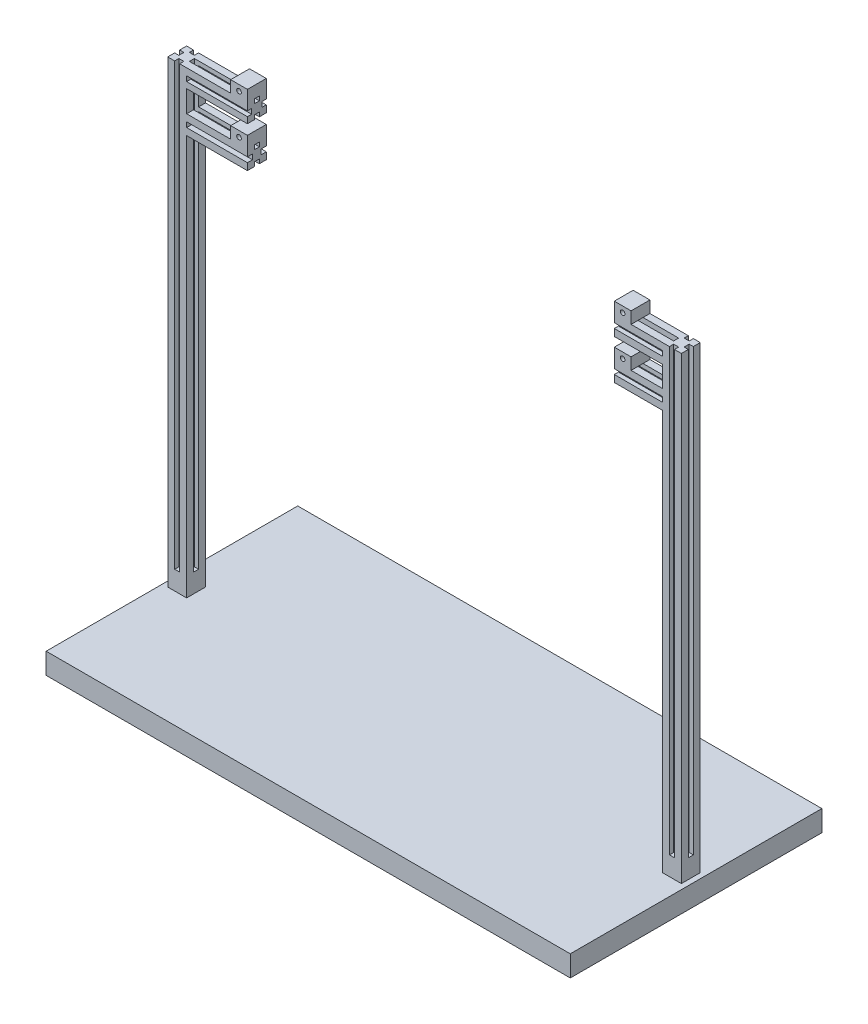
SolidWorks part; units mm, degrees
ref_plane "Front Plane" through (0, 0, 0) normal (0, 0, 1) x (1, 0, 0)
ref_plane "Top Plane" through (0, 0, 0) normal (0, 1, 0) x (1, 0, 0)
ref_plane "Right Plane" through (0, 0, 0) normal (1, 0, 0) x (0, 0, -1)
sketch "Schizzo1" plane through (0, 0, 0) normal (0, 1, 0) x (1, 0, 0)
  line L1 (-625, 300) -> (625, 300)
  line L2 (-625, 300) -> (-625, -300)
  line L3 (-625, -300) -> (625, -300)
  line L4 (625, 300) -> (625, -300)
  dimension "D1" = 1250
  dimension "D2" = 625
  dimension "D3" = 600
  dimension "D4" = 300
extrude "Estrusione-Estrusione1" add sketch "Schizzo1" along normal blind 50
sketch "Schizzo2" plane through (0, 50, 0) normal (0, 1, 0) x (1, 0, 0)
  line L0 (-625, -300) -> (625, -300) construction
  line L1 (-612.5, 22.5) -> (-567.5, 22.5)
  line L2 (-612.5, 22.5) -> (-612.5, -22.5)
  line L3 (-612.5, -22.5) -> (-567.5, -22.5)
  line L4 (-567.5, 22.5) -> (-567.5, -22.5)
  dimension "D1" = 45
  dimension "D2" = 45
  dimension "D3" = 277.5
  dimension "D4" = 612.5
extrude "Estrusione-Estrusione2" add sketch "Schizzo2" along normal blind 1095
sketch "Schizzo3" plane through (0, 50, 0) normal (0, 1, 0) x (1, 0, 0)
  line L0 (625, 300) -> (-625, 300) construction
  line L1 (567.5, 22.5) -> (612.5, 22.5)
  line L2 (567.5, 22.5) -> (567.5, -22.5)
  line L3 (567.5, -22.5) -> (612.5, -22.5)
  line L4 (612.5, 22.5) -> (612.5, -22.5)
  dimension "D1" = 45
  dimension "D2" = 45
  dimension "D3" = 277.5
  dimension "D4" = 612.5
extrude "Estrusione-Estrusione3" add sketch "Schizzo3" along normal blind 1095
sketch "Schizzo4" plane through (0, 1145, 0) normal (0, 1, 0) x (1, 0, 0)
  line L0 (-612.5, 22.5) -> (-612.5, -22.5) construction
  line L1 (-612.5, -22.5) -> (-567.5, -22.5)
  line L2 (-612.5, -22.5) -> (-612.5, 22.5)
  line L3 (-612.5, 22.5) -> (-567.5, 22.5)
  line L4 (-567.5, -22.5) -> (-567.5, 22.5)
  line L5 (-612.5, 22.5) -> (-612.5, -22.5) construction
  line L6 (-497.3635, 0) -> (-565.7304, 0) construction
  line L7 (-596, -22.5) -> (-584, -22.5)
  line L8 (-596, -22.5) -> (-596, -12.5)
  line L9 (-596, -12.5) -> (-584, -12.5)
  line L10 (-584, -22.5) -> (-584, -12.5)
  line L12 (-612.5, 6) -> (-602.5, 6)
  line L13 (-612.5, 6) -> (-612.5, -6)
  line L14 (-612.5, -6) -> (-602.5, -6)
  line L15 (-567.5, 6) -> (-577.5, 6)
  line L16 (-567.5, 6) -> (-567.5, -6)
  line L17 (-567.5, -6) -> (-577.5, -6)
  line L18 (-577.5, 6) -> (-577.5, -6)
  line L19 (-584, 22.5) -> (-584, 12.5)
  line L20 (-612.5, 6) -> (-612.5, -6)
  line L21 (-596, 12.5) -> (-584, 12.5)
  line L22 (-596, 22.5) -> (-596, 12.5)
  line L23 (-531.5443, -29.149) -> (-559.7543, -9.972) construction
  line L24 (0, 215.9687) -> (0, -207.4603) construction
  line L30 (-602.5, 6) -> (-602.5, -6)
  dimension "D1" = 12
  dimension "D2" = 16.5
  dimension "D3" = 12
  dimension "D4" = 10
  dimension "D5" = 10
  dimension "D6" = 16.5
  dimension "D7" = 22.5
  dimension "D8" = 10
  dimension "D9" = 12
  dimension "D10" = 16.5
extrude "Taglio-Estrusione1" cut sketch "Schizzo4" against normal blind 1050 contours L3 L22 L21 L19 | L30 L12 L2 L14 | L1 L10 L9 L8 | L15 L18 L17 L4
sketch "Schizzo5" plane through (0, 1145, 0) normal (0, 1, 0) x (1, 0, 0)
  line L0 (590, 25.1741) -> (590, -27.4304) construction
  line L1 (567.5, 22.5) -> (612.5, 22.5)
  line L2 (567.5, 22.5) -> (567.5, -22.5)
  line L3 (567.5, -22.5) -> (612.5, -22.5)
  line L4 (612.5, 22.5) -> (612.5, -22.5)
  line L5 (512.2544, 0) -> (588.0969, 0) construction
  line L6 (612.5, -6) -> (602.5, -6)
  line L7 (584, -22.5) -> (596, -22.5)
  line L8 (584, -22.5) -> (584, -12.5)
  line L9 (584, -12.5) -> (596, -12.5)
  line L10 (596, -22.5) -> (596, -12.5)
  line L11 (567.5, 6) -> (577.5, 6)
  line L12 (567.5, 6) -> (567.5, -6)
  line L13 (567.5, -6) -> (577.5, -6)
  line L14 (577.5, 6) -> (577.5, -6)
  line L15 (602.5, 6) -> (602.5, -6)
  line L16 (612.5, 6) -> (602.5, 6)
  line L17 (596, 22.5) -> (596, 12.5)
  line L18 (584, 22.5) -> (584, 12.5)
  line L19 (584, 12.5) -> (596, 12.5)
  dimension "D1" = 22.5
  dimension "D2" = 22.5
  dimension "D3" = 12
  dimension "D4" = 6
  dimension "D5" = 10
  dimension "D6" = 10
  dimension "D7" = 12
  dimension "D8" = 6
extrude "Taglio-Estrusione2" cut sketch "Schizzo5" against normal blind 1050 contours L18 L19 L17 L1 | L14 L11 L2 L13 | L3 L10 L9 L8 | L4 L16 L15 L6
sketch "Schizzo6" plane through (-567.5, 0, 0) normal (1, 0, 0) x (0, 0, -1)
  line L0 (-22.5, 1145) -> (-22.5, 50) construction
  line L1 (-22.5, 1050) -> (22.5, 1050)
  line L2 (-22.5, 754.8611) -> (-22.5, 1005)
  line L3 (-22.5, 1005) -> (22.5, 1005)
  line L4 (22.5, 754.8611) -> (22.5, 1005)
  line L5 (22.5, 1145) -> (22.5, 50) construction
  line L6 (6, 95) -> (6, 1145) construction
  line L7 (-6, 1005) -> (6, 1005)
  line L8 (-6, 1005) -> (-6, 1015)
  line L9 (-6, 1015) -> (6, 1015)
  line L10 (6, 1005) -> (6, 1015)
  line L12 (-22.5, 1145) -> (-22.5, 50) construction
  line L13 (22.5, 1145) -> (22.5, 50) construction
  line L14 (-6, 95) -> (-6, 1145) construction
  line L15 (-6, 1050) -> (6, 1050)
  line L16 (-6, 1050) -> (-6, 1040)
  line L17 (-6, 1040) -> (6, 1040)
  line L18 (6, 1050) -> (6, 1040)
  line L19 (6, 95) -> (6, 1145) construction
  line L20 (-31.6355, 1027.5) -> (43.3872, 1027.5) construction
  line L21 (22.5, 1033.5) -> (9.7907, 1033.5)
  line L22 (22.5, 1033.5) -> (22.5, 1021.5)
  line L23 (22.5, 1021.5) -> (9.7907, 1021.5)
  line L24 (9.7907, 1033.5) -> (9.7907, 1021.5)
  line L25 (-22.5, 1033.5) -> (-10.5, 1033.5)
  line L26 (-22.5, 50) -> (22.5, 50) construction
  line L27 (-22.5, 1033.5) -> (-22.5, 1021.5)
  line L28 (-22.5, 1021.5) -> (-10.5, 1021.5)
  line L29 (-10.5, 1033.5) -> (-10.5, 1021.5)
  dimension "D2" = 45
  dimension "D3" = 10
  dimension "D4" = 12
  dimension "D5" = 12
  dimension "D6" = 12
  dimension "D7" = 6
  dimension "D8" = 22.5
  dimension "D9" = 6
  dimension "D10" = 955
  dimension "D11" = 10
  dimension "D12" = 12
extrude "Estrusione-Estrusione4" add sketch "Schizzo6" along normal blind 145 contours L20 L29 L28 L3 M6 M4 | L20 L9 M4 M2 | L20 L3 L23 L24 M2 M8 | L20 L17 M4 M2 | L29 L20 L1 L25 M4 M6 | L20 L24 L21 L1 M2 M8
sketch "Schizzo9" plane through (567.5, 0, 0) normal (-1, 0, 0) x (0, 0, 1)
  line L0 (-22.5, 1145) -> (-22.5, 50) construction
  line L1 (-22.5, 1005) -> (22.5, 1005)
  line L2 (-22.5, 1005) -> (-22.5, 1050)
  line L3 (-22.5, 1050) -> (22.5, 1050)
  line L4 (22.5, 1005) -> (22.5, 1050)
  line L5 (22.5, 1145) -> (22.5, 50) construction
  line L7 (6, 95) -> (6, 1145) construction
  line L8 (-6, 1005) -> (6, 1005)
  line L9 (-6, 1005) -> (-6, 1015)
  line L10 (-6, 1015) -> (6, 1015)
  line L11 (6, 1005) -> (6, 1015)
  line L12 (-6, 95) -> (-6, 1145) construction
  line L13 (-6, 1050) -> (6, 1050)
  line L14 (-6, 1050) -> (-6, 1040)
  line L15 (-6, 1040) -> (6, 1040)
  line L16 (6, 1050) -> (6, 1040)
  line L17 (6, 95) -> (6, 1145) construction
  line L18 (-28.8999, 1027.5) -> (28.9688, 1027.5) construction
  line L19 (-22.5, 1033.5) -> (-12.5, 1033.5)
  line L20 (-22.5, 1033.5) -> (-22.5, 1021.5)
  line L21 (-22.5, 1021.5) -> (-12.5, 1021.5)
  line L22 (-12.5, 1033.5) -> (-12.5, 1021.5)
  line L23 (22.5, 1033.5) -> (12.5, 1033.5)
  line L24 (22.5, 1033.5) -> (22.5, 1021.5)
  line L25 (22.5, 1021.5) -> (12.5, 1021.5)
  line L26 (12.5, 1033.5) -> (12.5, 1021.5)
  line L28 (-300, 50) -> (300, 50) construction
  dimension "D1" = 955
  dimension "D2" = 45
  dimension "D3" = 10
  dimension "D4" = 10
  dimension "D5" = 12
  dimension "D6" = 10
  dimension "D7" = 10
  dimension "D8" = 12
  dimension "D9" = 6
extrude "Estrusione-Estrusione6" add sketch "Schizzo9" along normal blind 115 contours L18 L15 M4 M2 | L18 L10 M4 M2 | L18 L1 L25 L26 M2 M8 | L18 L22 L21 L1 M6 M4 | L22 L18 L3 L19 M4 M6 | L18 L26 L23 L4 L3 M2
sketch "Schizzo10" plane through (0, 1050, 0) normal (0, 1, 0) x (1, 0, 0)
  line L0 (-422.5, -22.5) -> (-567.5, -22.5) construction
  line L1 (-422.5, 22.5) -> (-462.5, 22.5)
  line L2 (-422.5, 22.5) -> (-422.5, -22.5)
  line L3 (-422.5, -22.5) -> (-462.5, -22.5)
  line L4 (-462.5, 22.5) -> (-462.5, -22.5)
  dimension "D1" = 40
extrude "Estrusione-Estrusione7" add sketch "Schizzo10" along normal blind 28
sketch "Schizzo11" plane through (0, 0, 22.5) normal (0, 0, 1) x (1, 0, 0)
  line L0 (-462.5, 1078) -> (-462.5, 1050) construction
  line L1 (-462.5, 1078) -> (-422.5, 1078) construction
  circle A0 centre (-442.5, 1064) radius 5.5
  dimension "D1" = 11
  dimension "D2" = 20
  dimension "D3" = 14
extrude "Taglio-Estrusione3" cut sketch "Schizzo11" against normal blind 45
sketch "Schizzo12" plane through (0, 1050, 0) normal (0, 1, 0) x (1, 0, 0)
  line L0 (452.5, -22.5) -> (567.5, -22.5) construction
  line L1 (452.5, 22.5) -> (492.5, 22.5)
  line L2 (452.5, 22.5) -> (452.5, -22.5)
  line L3 (452.5, -22.5) -> (492.5, -22.5)
  line L4 (492.5, 22.5) -> (492.5, -22.5)
  dimension "D1" = 40
extrude "Estrusione-Estrusione8" add sketch "Schizzo12" along normal blind 28
sketch "Schizzo13" plane through (0, 0, 22.5) normal (0, 0, 1) x (1, 0, 0)
  line L0 (452.5, 1033.5) -> (452.5, 1078) construction
  line L1 (452.5, 1078) -> (492.5, 1078) construction
  circle A0 centre (472.5, 1064) radius 5.5
  dimension "D1" = 11
  dimension "D2" = 20
  dimension "D3" = 14
extrude "Taglio-Estrusione4" cut sketch "Schizzo13" against normal blind 45
sketch "Schizzo14" plane through (-567.5, 0, 0) normal (1, 0, 0) x (0, 0, -1)
  line L0 (22.5, 1145) -> (22.5, 1050) construction
  line L1 (-22.5, 1145) -> (22.5, 1145)
  line L2 (-22.5, 1145) -> (-22.5, 1101.9247)
  line L3 (-22.5, 1101.9247) -> (22.5, 1101.9247)
  line L4 (22.5, 1145) -> (22.5, 1101.9247)
  line L5 (-6, 1050) -> (-6, 1145) construction
  line L6 (-22.5, 1128.5) -> (-12.5, 1128.5)
  line L7 (-22.5, 1128.5) -> (-22.5, 1116.5)
  line L8 (-22.5, 1116.5) -> (-12.5, 1116.5)
  line L9 (-12.5, 1128.5) -> (-12.5, 1116.5)
  line L10 (22.5, 1130.4247) -> (12.5, 1130.4247)
  line L11 (22.5, 1130.4247) -> (22.5, 1118.4247)
  line L12 (22.5, 1118.4247) -> (12.5, 1118.4247)
  line L13 (12.5, 1130.4247) -> (12.5, 1118.4247)
  line L14 (-6, 1101.9247) -> (6, 1101.9247)
  line L15 (-6, 1101.9247) -> (-6, 1111.9247)
  line L16 (-6, 1111.9247) -> (6, 1111.9247)
  line L17 (6, 1101.9247) -> (6, 1111.9247)
  line L18 (6, 1050) -> (6, 1145) construction
  line L20 (-6, 1145) -> (6, 1145)
  line L21 (-6, 1145) -> (-6, 1135)
  line L22 (-6, 1135) -> (6, 1135)
  line L23 (6, 1145) -> (6, 1135)
  dimension "D1" = 10
  dimension "D2" = 12
  dimension "D3" = 10
  dimension "D4" = 12
  dimension "D5" = 10
  dimension "D6" = 10
  dimension "D7" = 16.5
  dimension "D8" = 16.5
extrude "Estrusione-Estrusione9" add sketch "Schizzo14" along normal blind 145 contours L1 L23 L22 L16 L17 L3 L4 L12 L13 L10 M3 | L6 L9 L8 L3 M1 M3 M4
sketch "Schizzo15" plane through (0, 1145, 0) normal (0, 1, 0) x (1, 0, 0)
  line L0 (-584, -22.5) -> (-422.5, -22.5) construction
  line L1 (-422.5, 22.5) -> (-462.5, 22.5)
  line L2 (-422.5, 22.5) -> (-422.5, -22.5)
  line L3 (-422.5, -22.5) -> (-462.5, -22.5)
  line L4 (-462.5, 22.5) -> (-462.5, -22.5)
  dimension "D1" = 40
extrude "Estrusione-Estrusione10" add sketch "Schizzo15" along normal blind 28
sketch "Schizzo16" plane through (0, 0, 22.5) normal (0, 0, 1) x (1, 0, 0)
  line L0 (-462.5, 1173) -> (-462.5, 1145) construction
  line L1 (-462.5, 1173) -> (-422.5, 1173) construction
  circle A0 centre (-442.5, 1159) radius 5.5
  dimension "D1" = 11
  dimension "D2" = 20
  dimension "D3" = 14
extrude "Taglio-Estrusione5" cut sketch "Schizzo16" against normal blind 45
sketch "Schizzo17" plane through (567.5, 0, 0) normal (-1, 0, 0) x (0, 0, 1)
  line L0 (-22.5, 1145) -> (-22.5, 1050) construction
  line L1 (22.5, 1145) -> (-22.5, 1145)
  line L2 (22.5, 1145) -> (22.5, 1100)
  line L3 (22.5, 1100) -> (-22.5, 1100)
  line L4 (-22.5, 1145) -> (-22.5, 1100)
  line L5 (-6, 1050) -> (-6, 1145) construction
  line L6 (22.5, 1128.5) -> (12.5, 1128.5)
  line L7 (22.5, 1128.5) -> (22.5, 1116.5)
  line L8 (22.5, 1116.5) -> (12.5, 1116.5)
  line L9 (12.5, 1128.5) -> (12.5, 1116.5)
  line L10 (-22.5, 1128.5) -> (-12.5, 1128.5)
  line L11 (-22.5, 1128.5) -> (-22.5, 1116.5)
  line L12 (-22.5, 1116.5) -> (-12.5, 1116.5)
  line L13 (-12.5, 1128.5) -> (-12.5, 1116.5)
  line L14 (-6, 1100) -> (6, 1100)
  line L15 (-6, 1100) -> (-6, 1110)
  line L16 (-6, 1110) -> (6, 1110)
  line L17 (6, 1100) -> (6, 1110)
  line L18 (6, 1050) -> (6, 1145) construction
  line L20 (-6, 1145) -> (6, 1145)
  line L21 (-6, 1145) -> (-6, 1132.027)
  line L22 (-6, 1132.027) -> (6, 1132.027)
  line L23 (6, 1145) -> (6, 1132.027)
  dimension "D1" = 45
  dimension "D2" = 10
  dimension "D3" = 10
  dimension "D4" = 12
  dimension "D5" = 12
  dimension "D6" = 10
  dimension "D7" = 16.5
  dimension "D8" = 16.5
extrude "Estrusione-Estrusione11" add sketch "Schizzo17" along normal blind 115 contours L22 L21 L1 L4 L10 L13 L12 L3 L15 L16 M1 | L9 L6 L2 L3 L8 M4 M1 M3
sketch "Schizzo18" plane through (0, 1145, 0) normal (0, 1, 0) x (1, 0, 0)
  line L0 (452.5, -22.5) -> (584, -22.5) construction
  line L1 (452.5, 22.5) -> (492.5, 22.5)
  line L2 (452.5, 22.5) -> (452.5, -22.5)
  line L3 (452.5, -22.5) -> (492.5, -22.5)
  line L4 (492.5, 22.5) -> (492.5, -22.5)
  dimension "D1" = 40
extrude "Estrusione-Estrusione12" add sketch "Schizzo18" along normal blind 28
sketch "Schizzo19" plane through (0, 0, 22.5) normal (0, 0, 1) x (1, 0, 0)
  line L0 (452.5, 1128.5) -> (452.5, 1173) construction
  line L1 (452.5, 1173) -> (492.5, 1173) construction
  circle A0 centre (472.5, 1159) radius 5.5
  dimension "D1" = 11
  dimension "D2" = 20
  dimension "D3" = 14
extrude "Taglio-Estrusione6" cut sketch "Schizzo19" against normal blind 45
